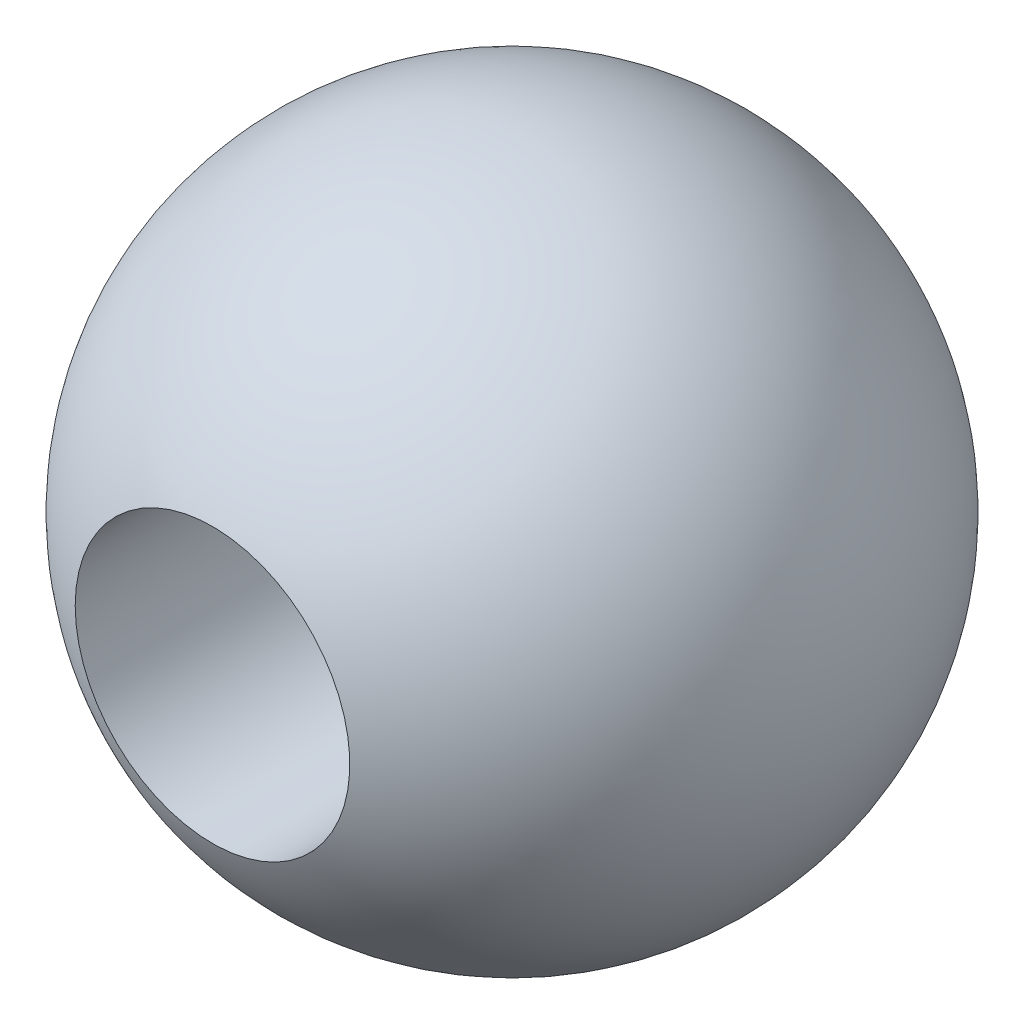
SolidWorks part; units mm, degrees
ref_plane "Front Plane" through (0, 0, 0) normal (0, 0, 1) x (1, 0, 0)
ref_plane "Top Plane" through (0, 0, 0) normal (0, 1, 0) x (1, 0, 0)
ref_plane "Right Plane" through (0, 0, 0) normal (1, 0, 0) x (0, 0, -1)
sketch "Sketch1" plane through (0, 0, 0) normal (0, 0, 1) x (1, 0, 0)
  line L0 (0, 0) -> (0, 12)
  arc A0 (0, 12) -> (0, 0) centre (0, 6) cw
  dimension "D1" = 6
revolve "Revolve1" add sketch "Sketch1" angle 360 about L0
sketch "Sketch2" plane through (0, 0, 0) normal (0, 0, 1) x (1, 0, 0)
  circle A0 centre (0, 6) radius 2.5
  circle A1 centre (0, 6) radius 6 construction
  dimension "D1" = 5
extrude "Cut-Extrude1" cut sketch "Sketch2" along normal blind 8
